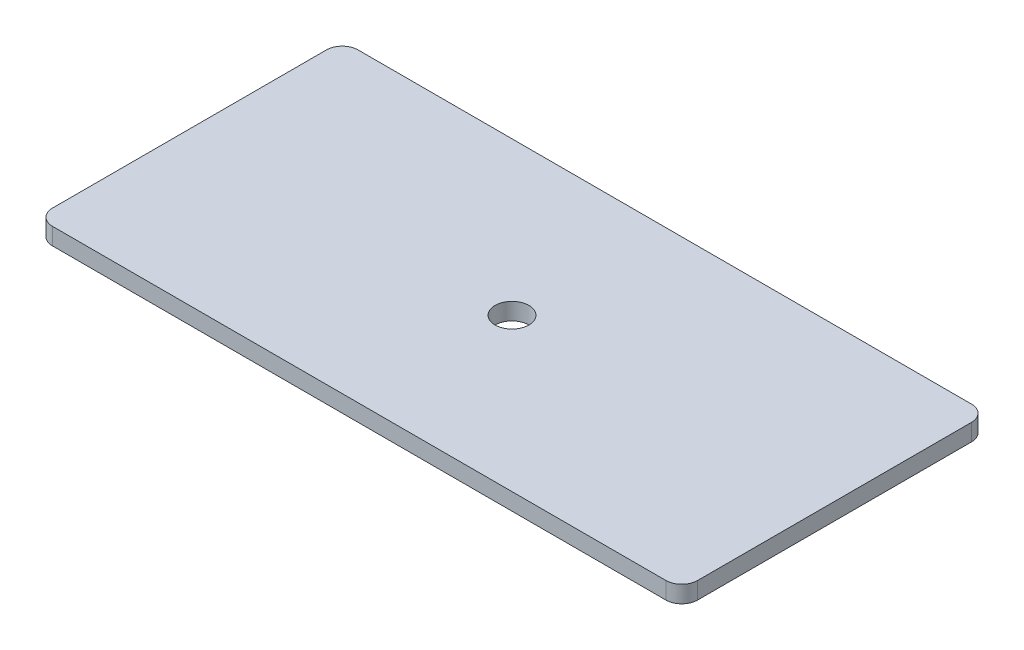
SolidWorks part; units mm, degrees
ref_plane "Front Plane" through (0, 0, 0) normal (0, 0, 1) x (1, 0, 0)
ref_plane "Top Plane" through (0, 0, 0) normal (0, 1, 0) x (1, 0, 0)
ref_plane "Right Plane" through (0, 0, 0) normal (1, 0, 0) x (0, 0, -1)
sketch "Sketch1" plane through (0, 0, 0) normal (0, 1, 0) x (1, 0, 0)
  line L0 (95, -40.3358) -> (95, 40.3358)
  line L1 (-90.3358, -45) -> (90.3358, -45)
  line L2 (-95, 40.3358) -> (-95, -40.3358)
  line L3 (90.3358, 45) -> (-90.3358, 45)
  arc A0 (95, 40.3358) -> (90.3358, 45) centre (90.3358, 40.3358) ccw
  arc A1 (90.3358, -45) -> (95, -40.3358) centre (90.3358, -40.3358) ccw
  arc A2 (-95, -40.3358) -> (-90.3358, -45) centre (-90.3358, -40.3358) ccw
  arc A3 (-90.3358, 45) -> (-95, 40.3358) centre (-90.3358, 40.3358) ccw
extrude "Boss-Extrude1" add sketch "Sketch1" along normal blind 5
sketch "Sketch2" plane through (0, 5, 0) normal (0, 1, 0) x (1, 0, 0)
  circle A0 centre (0, 0) radius 5
  dimension "D1" = 10
extrude "Cut-Extrude1" cut sketch "Sketch2" against normal through all
